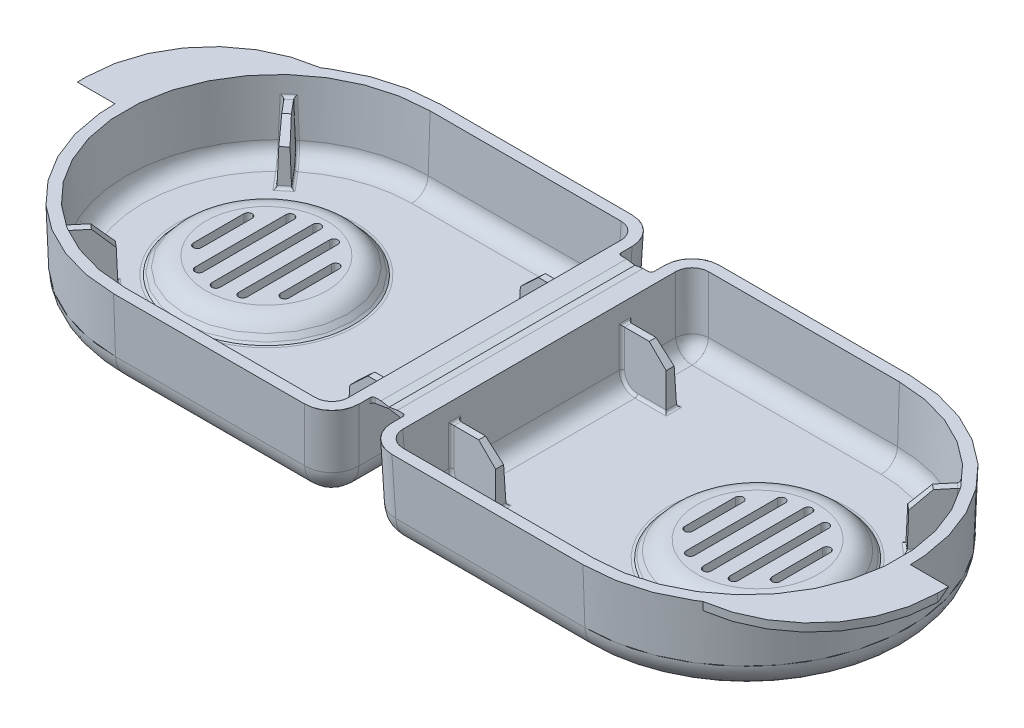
SolidWorks part; units mm, degrees
ref_plane "Front Plane" through (0, 0, 0) normal (0, 0, 1) x (1, 0, 0)
ref_plane "Top Plane" through (0, 0, 0) normal (0, 1, 0) x (1, 0, 0)
ref_plane "Right Plane" through (0, 0, 0) normal (1, 0, 0) x (0, 0, -1)
sketch "MainProfile" plane through (0, 0, 0) normal (0, 1, 0) x (1, 0, 0)
  line L0 (0, 30) -> (0, -30) construction
  line L1 (3, 30) -> (3, -30)
  line L2 (-73, 0) -> (73, 0) construction
  line L3 (3, 30) -> (43, 30)
  line L4 (-73, 30) -> (73, 30) construction
  line L5 (-73, 30) -> (-73, -30) construction
  line L6 (-73, -30) -> (73, -30) construction
  line L7 (73, 30) -> (73, -30) construction
  line L8 (43, -30) -> (3, -30)
  arc A0 (43, 30) -> (43, -30) centre (43, 0) cw
  dimension "D1" = 60
  dimension "D2" = 70
  dimension "D3" = 3
ref_plane "Ribheight" through (0, -3.5, 0) normal (0, 1, 0) x (1, 0, 0)
sketch "Sketch2" plane through (0, 0, 0) normal (0, 1, 0) x (1, 0, 0)
  line L0 (43, -30) -> (3, -30) construction
  line L1 (3, 30) -> (3, -30) construction
  line L2 (3, 30) -> (43, 30) construction
  line L3 (43, -30) -> (3, -30)
  line L4 (3, 30) -> (3, -30)
  line L5 (3, 30) -> (43, 30)
  arc A0 (43, -30) -> (43, 30) centre (43, 0) ccw construction
  arc A1 (43, -30) -> (43, 30) centre (43, 0) ccw
extrude "Boss-Extrude1" add sketch "Sketch2" against normal blind 15 draft 2
fillet "Fillet1" radius 5 6 edges at (23.2619, -15, -29.4762) (3.5238, -15, 0) (23.2619, -15, 29.4762) (72.4762, -15, 0) (3.2619, -7.5, -29.7381) (3.2619, -7.5, 29.7381)
sketch "Sketch3" plane through (0, -15, 0) normal (0, -1, 0) x (1, 0, 0)
  line L0 (0, 0) -> (45, 0) construction
  circle A0 centre (45, 0) radius 15
  dimension "D1" = 30
  dimension "D2" = 45
extrude "Cut-Extrude1" cut sketch "Sketch3" against normal blind 3 draft 40 contours A0
fillet "Fillet2" radius 3 2 edges at (45, -15, -15) (45, -12, -12.4827)
shell "Shell1" thickness 2
sketch "HingeS" plane through (2.9963, 0.1046, 0) normal (-0.9994, -0.0349, 0) x (0, 0, 1)
  line L1 (-25.003, -0.1047) -> (24.9681, -0.1047)
  line L2 (-25.003, -0.1047) -> (-25.003, -1.1047)
  line L3 (-25.003, -1.1047) -> (24.9681, -1.1047)
  line L4 (24.9681, -0.1047) -> (24.9681, -1.1047)
  line L5 (24.6477, -10.2854) -> (25.003, -0.1047) construction
  dimension "D1" = 1
sketch "Sketch4" plane through (0, -10, 0) normal (0, -1, 0) x (1, 0, 0)
  line L0 (45, 9.25) -> (45, -9.25) construction
  line L1 (45.75, 9.25) -> (45.75, -9.25)
  line L2 (44.25, 9.25) -> (44.25, -9.25)
  line L3 (49, -8.3404) -> (49, 8.3404) construction
  line L4 (48.25, -8.3404) -> (48.25, 8.3404)
  line L5 (49.75, -8.3404) -> (49.75, 8.3404)
  line L6 (53, -4.6435) -> (53, 4.6435) construction
  line L7 (52.25, -4.6435) -> (52.25, 4.6435)
  line L8 (53.75, -4.6435) -> (53.75, 4.6435)
  line L9 (45, -6.677) -> (45, -19.9204) construction
  line L10 (37, -4.6435) -> (37, 4.6435) construction
  line L11 (37.75, -4.6435) -> (37.75, 4.6435)
  line L12 (36.25, -4.6435) -> (36.25, 4.6435)
  line L13 (41, -8.3404) -> (41, 8.3404) construction
  line L14 (41.75, -8.3404) -> (41.75, 8.3404)
  line L15 (40.25, -8.3404) -> (40.25, 8.3404)
  circle A0 centre (45, 0) radius 10 construction
  arc A1 (45.75, 9.25) -> (44.25, 9.25) centre (45, 9.25) ccw
  arc A2 (44.25, -9.25) -> (45.75, -9.25) centre (45, -9.25) ccw
  arc A3 (48.25, -8.3404) -> (49.75, -8.3404) centre (49, -8.3404) ccw
  arc A4 (49.75, 8.3404) -> (48.25, 8.3404) centre (49, 8.3404) ccw
  arc A5 (52.25, -4.6435) -> (53.75, -4.6435) centre (53, -4.6435) ccw
  arc A6 (53.75, 4.6435) -> (52.25, 4.6435) centre (53, 4.6435) ccw
  arc A7 (37.75, -4.6435) -> (36.25, -4.6435) centre (37, -4.6435) cw
  arc A8 (36.25, 4.6435) -> (37.75, 4.6435) centre (37, 4.6435) cw
  arc A9 (41.75, -8.3404) -> (40.25, -8.3404) centre (41, -8.3404) cw
  arc A10 (40.25, 8.3404) -> (41.75, 8.3404) centre (41, 8.3404) cw
  point P5 (45, 0)
  point P10 (49, 0)
  point P19 (53, 0)
  point P28 (37, 0)
  point P35 (41, 0)
  dimension "D1" = 20
  dimension "D2" = 45
  dimension "D3" = 1.5
  dimension "D4" = 1.5
  dimension "D5" = 4
  dimension "D6" = 1.5
  dimension "D7" = 4
extrude "Cut-Extrude2" cut sketch "Sketch4" along normal through all draft 2
sketch "Sketch5" plane through (0, -3.5, 0) normal (0, 1, 0) x (1, 0, 0)
  line L1 (0, 0) -> (83.533, 0) construction
  line L3 (5.0012, 25.0006) -> (5.0012, -25.0006) construction
  line L4 (63.1587, 21.6408) -> (45, 0) construction
  line L6 (75.8458, -12.7842) -> (75.9294, -12.9513) construction
  line L11 (63.1587, 21.6408) -> (62.2012, 22.4442)
  line L12 (62.2012, 22.4442) -> (56.7375, 15.9329)
  line L13 (56.7375, 15.9329) -> (57.6951, 15.1294)
  line L14 (57.6951, 15.1294) -> (63.1587, 21.6408)
  line L16 (4.7512, 16.25) -> (13.2512, 16.25)
  line L17 (4.7512, 16.25) -> (4.7512, 15)
  line L18 (4.7512, 15) -> (13.2512, 15)
  line L19 (13.2512, 16.25) -> (13.2512, 15)
  dimension "D1" = 50
  dimension "D2" = 15
  dimension "D3" = 1.25
  dimension "D4" = 0.25
  dimension "D5" = 45
  dimension "D6" = 8.5
  dimension "D7" = 1.25
  dimension "D8" = 8.5
  dimension "D9" = 28.25
extrude "Rib1" add sketch "Sketch5" against normal up to body draft 2 separate body
chamfer "Chamfer2" distance 3 angle 45 2 edges at (57.2163, -3.5, -15.5311) (13.2512, -3.5, -15.625)
mirror "Mirror4" about plane through (0, 0, 0) normal (0, 0, 1) of "Chamfer2", "Rib1"
mirror "Mirror3" about plane through (0, 0, 0) normal (1, 0, 0)
sketch "Sketch6" plane through (0, 0, 0) normal (0, 0, 1) x (1, 0, 0)
  line L0 (-3, 0) -> (3, 0) construction
  line L1 (3, 0) -> (3.0349, -1)
  line L2 (3.0349, -1) -> (0, -0.5)
  line L3 (0, -0.5) -> (-3.0349, -1)
  line L4 (-3.0349, -1) -> (-3, 0)
  line L5 (-3.3553, -10.1745) -> (-3, 0) construction
  line L6 (3.3553, -10.1745) -> (3, 0) construction
  line L7 (3, 0) -> (1.5, 0)
  line L8 (1.5, 0) -> (0, -0.25)
  line L9 (0, -0.25) -> (-1.5, 0)
  line L10 (-1.5, 0) -> (-3, 0)
  dimension "D1" = 0.25
  dimension "D2" = 6
  dimension "D3" = 1
  dimension "D4" = 0.25
  dimension "D5" = 1.5
extrude "Boss-Extrude6" add sketch "Sketch6" along normal mid plane 45 contours L9 L10 L4 L3 L2 L1 L7 L8
sketch "Sketch10" plane through (0, 0, 0) normal (0, 1, 0) x (1, 0, 0)
  line L0 (72, 0) -> (-93.0471, 0) construction
  line L2 (80, 0) -> (80, -2)
  line L3 (0, 0) -> (0, -48.8704) construction
  line L4 (-71.894, 0) -> (-79.894, 0)
  line L5 (-79.894, 0) -> (-79.894, 2)
  line L6 (80, 0) -> (80, 3)
  line L7 (80, 3) -> (72, 3)
  line L8 (72, 3) -> (72, 0)
  arc A1 (80, -2) -> (57.9027, -25) centre (56.9816, -2) cw
  arc A2 (57.9027, -25) -> (72, 0) centre (42.0725, 0.4012) ccw
  arc A4 (-71.894, 0) -> (-57.4866, 25) centre (-41.9007, -0.6335) cw
  arc A6 (-79.894, 2) -> (-57.4866, 25) centre (-56.8861, 2) cw
  dimension "D1" = 8
  dimension "D4" = 8
  dimension "D5" = 2
  dimension "D7" = 3
  dimension "D2" = 2
  dimension "D6" = 25
extrude "Boss-Extrude8" add sketch "Sketch10" against normal blind 5 draft 2
ref_plane "Plane1" through (-85, 0, 0) normal (-1, 0, 0) x (0, 0, 1)
sketch "Sketch11" plane through (-85, 0, 0) normal (-1, 0, 0) x (0, 0, 1)
  line L1 (-26.7397, 0) -> (-26.7397, -1.25)
  line L2 (-26.7397, -1.25) -> (-1.7397, -1.25)
  line L4 (-0.25, 0) -> (-1.7397, -1.25)
  line L5 (-0.25, 0) -> (-26.7397, 0)
  line L6 (30, 0) -> (24.8431, 0) construction
  line L9 (-26.7397, -1.25) -> (-26.7397, -5.7554)
  line L10 (-26.7397, -5.7554) -> (0, -5.7554)
  line L12 (-2, 0) -> (0, 0) construction
  line L13 (-0.25, 0) -> (0, 0)
  line L15 (0, 0) -> (0, -5.7554)
  dimension "D2" = 40
  dimension "D4" = 1.25
  dimension "D1" = 0.25
  dimension "D3" = 25
extrude "Cut-Extrude4" cut sketch "Sketch11" against normal up to surface (28.8482 mm away)
ref_plane "Plane2" through (85, 0, 0) normal (1, 0, 0) x (0, 0, -1)
sketch "Sketch13" plane through (85, 0, 0) normal (1, 0, 0) x (0, 0, -1)
  line L0 (-25.7066, 0) -> (3.5, 0) construction
  line L1 (-1.7876, -1.5) -> (0, 0)
  line L2 (-25.7066, 0) -> (-25.7066, -1.5) construction
  line L3 (-25.7066, -1.5) -> (-1.7876, -1.5)
  line L5 (-25.7066, -1.5) -> (-25.7066, -5.7632)
  line L6 (-25.7066, -5.7632) -> (3.5, -5.7632)
  line L7 (3.5, -5.7632) -> (3.5, 0)
  line L8 (0, 0) -> (3.5, 0)
  dimension "D1" = 1.5
  dimension "D2" = 40
  dimension "D3" = 3.5
extrude "Cut-Extrude5" cut sketch "Sketch13" against normal up to surface (12 mm away)
draft "Draft3" type of draft neutral plane draft angle 2 faces to draft 2 parameters "D1"=2
fillet "Fillet4" radius 0.5 68 edges at (-5.2388, -6.8023, 14.8847) (-10.9676, -13, 14.6683) (-10.9676, -13, 16.5817) (-6.2683, -12.158, 16.5523) (-10.9676, -13, -16.5817) (-6.2683, -12.158, -16.5523) (-10.9676, -13, -14.6683) (-6.2683, -12.158, -14.6977) (-58.9808, -13, -16.1456) (-57.5377, -13, -17.4026) (-60.2958, -11.9552, -20.6328) (-3.0175, -0.5, -22.5175) (3.0175, -0.5, -22.5175) (-3.0175, -0.5, 22.5175) (3.0175, -0.5, 22.5175) (-6.2683, -12.158, 14.6977) (-13.583, -13, 15.625) (-5.2388, -6.8023, 16.3653) (-5.1234, -3.5, 15.625) (-5.2388, -6.8023, -16.3653) (-13.583, -13, -15.625) (-5.1234, -3.5, -15.625) (-5.2388, -6.8023, -14.8847) (-57.003, -13, -15.277) (-61.6176, -12.0426, -19.34) (-61.6043, -3.5, -20.7602) (-61.6043, -3.5, 20.7602) (-60.2958, -11.9552, 20.6328) (-57.5377, -13, 17.4026) (-57.003, -13, 15.277) (-58.9808, -13, 16.1456) (-61.6176, -12.0426, 19.34) (5.2388, -6.8023, -14.8847) (6.2683, -12.158, -16.5523) (13.583, -13, -15.625) (10.9676, -13, -16.5817) (5.1234, -3.5, -15.625) (6.2683, -12.158, -14.6977) (10.9676, -13, -14.6683) (61.6176, -12.0426, -19.34) (57.003, -13, -15.277) (58.9808, -13, -16.1456) (61.6043, -3.5, -20.7602) (60.2958, -11.9552, -20.6328) (57.5377, -13, -17.4026) (5.2388, -6.8023, -16.3653) (5.2388, -6.8023, 16.3653) (13.583, -13, 15.625) (10.9676, -13, 14.6683) (6.2683, -12.158, 14.6977) (5.1234, -3.5, 15.625) (10.9676, -13, 16.5817) (6.2683, -12.158, 16.5523) (57.5377, -13, 17.4026) (58.9808, -13, 16.1456) (61.6176, -12.0426, 19.34) (61.6043, -3.5, 20.7602) (57.003, -13, 15.277) (60.2958, -11.9552, 20.6328) (5.2388, -6.8023, 14.8847)
